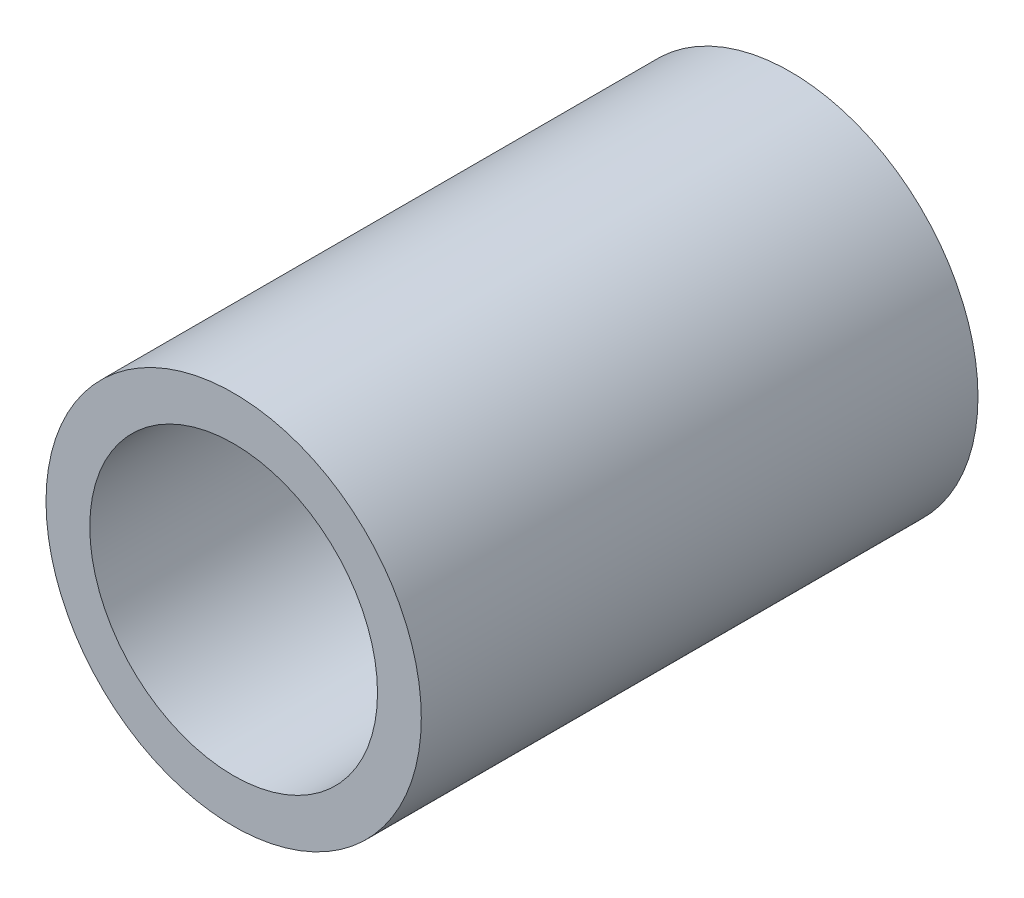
SolidWorks part; units mm, degrees
ref_plane "Face" through (0, 0, 0) normal (0, 0, 1) x (1, 0, 0)
ref_plane "Dessus" through (0, 0, 0) normal (0, 1, 0) x (1, 0, 0)
ref_plane "Droite" through (0, 0, 0) normal (1, 0, 0) x (0, 0, -1)
sketch "Esquisse1" plane through (0, 0, 0) normal (0, 0, 1) x (1, 0, 0)
  circle A0 centre (0, 0) radius 1.5
  circle A1 centre (0, 0) radius 1.15
  dimension "D1" = 3
  dimension "D2" = 2.3
extrude "Extrusion1" add sketch "Esquisse1" along normal blind 4.45
